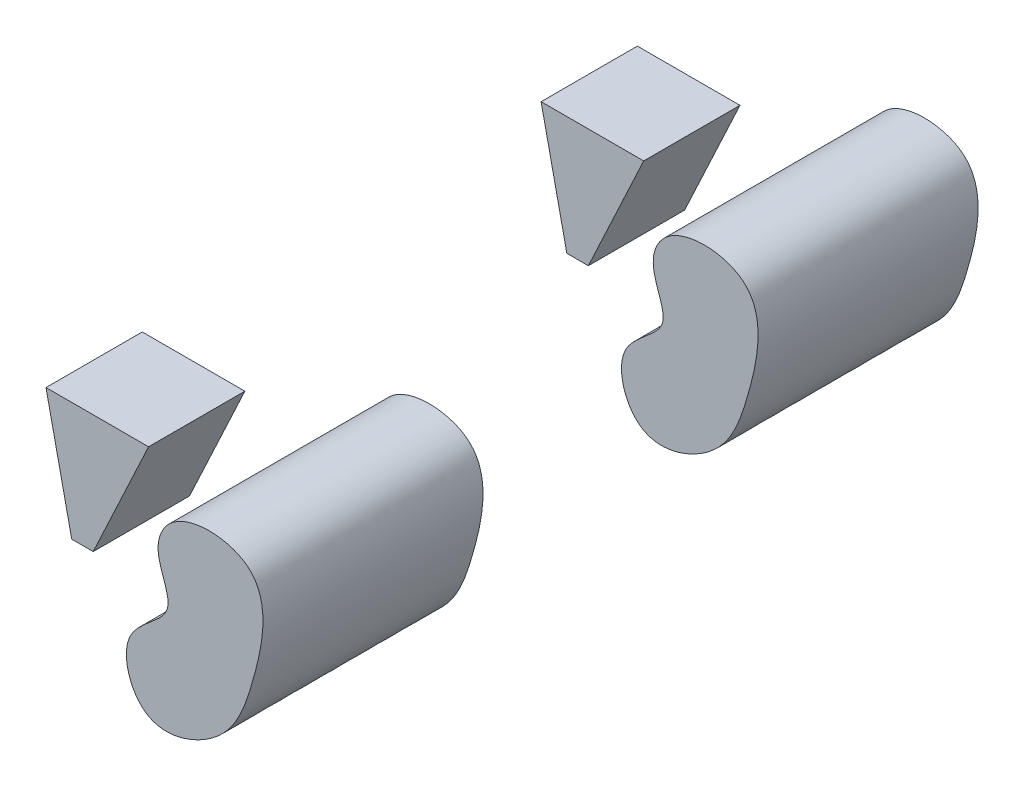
SolidWorks part; units mm, degrees
ref_plane "Front Plane" through (0, 0, 0) normal (0, 0, 1) x (1, 0, 0)
ref_plane "Top Plane" through (0, 0, 0) normal (0, 1, 0) x (1, 0, 0)
ref_plane "Right Plane" through (0, 0, 0) normal (1, 0, 0) x (0, 0, -1)
sketch "Sketch1" plane through (0, 0, 0) normal (0, 0, 1) x (1, 0, 0)
  line L0 (0, 0) -> (15.6216, 0)
  line L1 (15.6216, 0) -> (55.8838, 86.1424)
  line L2 (55.8838, 86.1424) -> (-18.7096, 86.1424)
  line L3 (-18.7096, 86.1424) -> (0, 0)
extrude "Boss-Extrude1" add sketch "Sketch1" along normal mid plane 70
sketch "Sketch2" plane through (0, 0, 0) normal (0, 0, 1) x (1, 0, 0)
  spline S0 degree 3 poles (159.355, -29.7951) (94.5341, -53.8649) (74.5529, 11.0095) (127.0597, 31.3112) (102.985, 65.7645) (118.2033, 104.1301) (195.6361, 102.4039) (178.5126, 22.1481) (159.355, -29.7951) (94.5341, -53.8649) (74.5529, 11.0095) knots -0.470074 -0.284938 -0.135363 0 0.119502 0.229795 0.319285 0.375456 0.529926 0.715062 0.864637 1 1.119502 1.229795 1.319285 only from (99.5807, -37.7575) to (99.5807, -37.7575)
extrude "Boss-Extrude2" add sketch "Sketch2" along normal mid plane 160 separate body
ref_plane "Plane1" through (-100, 0, 0) normal (1, 0, 0) x (0, 0, -1)
ref_plane "Plane2" through (0, 0, 180) normal (0, 0, 1) x (1, 0, 0)
mirror "Mirror1" about plane through (0, 0, 180) normal (0, 0, 1)
sketch "Sketch3" plane through (-100, 0, 0) normal (1, 0, 0) x (0, 0, -1)
  circle A0 centre (0, 44.6367) radius 25.5312
  circle A1 centre (-359.3011, 36.2195) radius 28.8209
